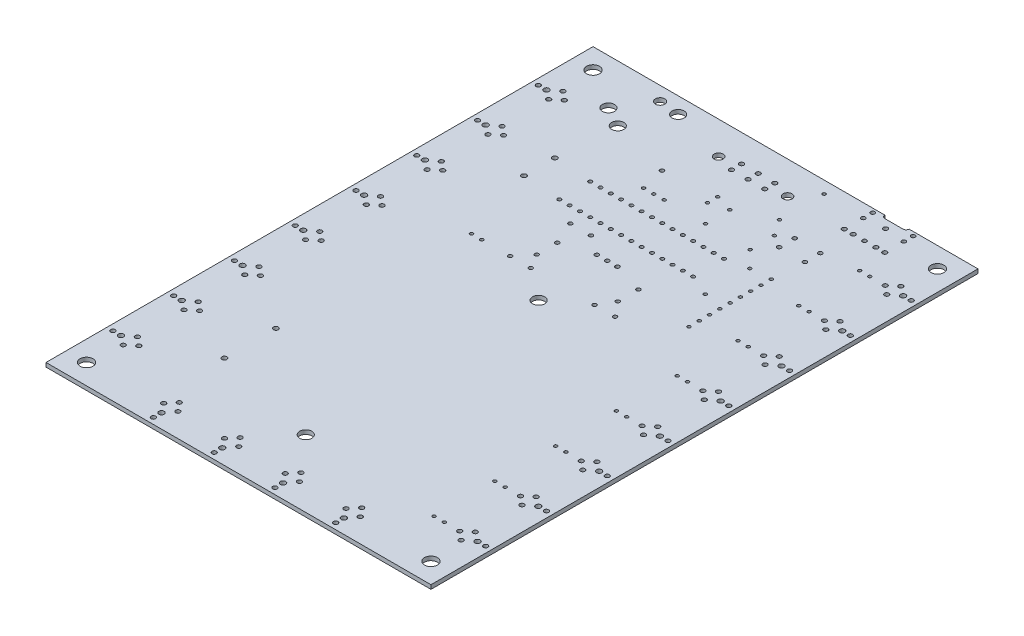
SolidWorks part; units mm, degrees
ref_plane "Plan de face" through (0, 0, 0) normal (0, 0, 1) x (1, 0, 0)
ref_plane "Plan de dessus" through (0, 0, 0) normal (0, 1, 0) x (1, 0, 0)
ref_plane "Plan de droite" through (0, 0, 0) normal (1, 0, 0) x (0, 0, -1)
sketch "Esquisse1" plane through (0, 0, 0) normal (0, 1, 0) x (1, 0, 0)
  line L0 (72.7481, 134.2517) -> (77.249, 134.2517)
  line L1 (0, 0) -> (95, 0)
  line L2 (0, 0) -> (0, 135)
  line L3 (0, 135) -> (71.9988, 135)
  line L4 (95, 0) -> (95, 135)
  line L5 (77.9983, 135) -> (95, 135)
  circle A0 centre (24.9987, 1.4986) radius 0.5512
  circle A1 centre (24.9987, 7.8994) radius 0.5512
  circle A2 centre (26.7487, 5.7988) radius 0.5512
  circle A3 centre (23.2486, 5.7988) radius 0.5512
  circle A4 centre (24.9987, 3.5001) radius 0.6502
  circle A5 centre (39.9999, 1.4986) radius 0.5512
  circle A6 centre (39.9999, 7.8994) radius 0.5512
  circle A7 centre (41.75, 5.7988) radius 0.5512
  circle A8 centre (38.2499, 5.7988) radius 0.5512
  circle A9 centre (39.9999, 3.5001) radius 0.6502
  circle A10 centre (54.9986, 1.4986) radius 0.5512
  circle A11 centre (54.9986, 7.8994) radius 0.5512
  circle A12 centre (56.7487, 5.7988) radius 0.5512
  circle A13 centre (53.2486, 5.7988) radius 0.5512
  circle A14 centre (54.9986, 3.5001) radius 0.6502
  circle A15 centre (69.9999, 1.4986) radius 0.5512
  circle A16 centre (69.9999, 7.8994) radius 0.5512
  circle A17 centre (71.7499, 5.7988) radius 0.5512
  circle A18 centre (68.2498, 5.7988) radius 0.5512
  circle A19 centre (69.9999, 3.5001) radius 0.6502
  circle A20 centre (21.0795, 35.6489) radius 0.5994
  circle A21 centre (21.0795, 22.9489) radius 0.5994
  circle A23 centre (47.5005, 16.5989) radius 1.5011
  circle A24 centre (72.1741, 118.905) radius 0.5004
  circle A25 centre (72.1741, 115.095) radius 0.5004
  circle A26 centre (65.8241, 115.095) radius 0.5004
  circle A27 centre (65.8241, 118.905) radius 0.5004
  circle A28 centre (40.0939, 94.3864) radius 0.4826
  circle A29 centre (35.0139, 94.3864) radius 0.4826
  circle A30 centre (60.452, 79.9922) radius 0.4826
  circle A31 centre (55.372, 79.9922) radius 0.4826
  circle A32 centre (34.5465, 80.0075) radius 0.4826
  circle A33 centre (39.6265, 80.0075) radius 0.4826
  circle A34 centre (57.5005, 83.599) radius 0.4826
  circle A35 centre (57.5005, 88.679) radius 0.4826
  circle A36 centre (37.5006, 83.599) radius 0.4826
  circle A37 centre (37.5006, 88.679) radius 0.4826
  circle A38 centre (20, 121.0996) radius 1.5011
  circle A39 centre (15.0012, 123.7996) radius 1.5011
  circle A40 centre (25.0012, 131.0005) radius 1.5011
  circle A41 centre (20, 131.5491) radius 1.1506
  circle A42 centre (19.0703, 98.8822) radius 0.5994
  circle A43 centre (19.0703, 106.5022) radius 0.5994
  circle A44 centre (5.0013, 5.0013) radius 1.6002
  circle A45 centre (5.0013, 129.9997) radius 1.6002
  circle A46 centre (89.9998, 129.9997) radius 1.6002
  circle A47 centre (89.9998, 5.0013) radius 1.6002
  circle A48 centre (61.5112, 105.8088) radius 0.4496
  circle A49 centre (58.9712, 105.8088) radius 0.4496
  circle A50 centre (56.4312, 105.8088) radius 0.4496
  circle A51 centre (53.8912, 105.8088) radius 0.4496
  circle A52 centre (51.3512, 105.8088) radius 0.4496
  circle A53 centre (48.8112, 105.8088) radius 0.4496
  circle A54 centre (46.2712, 105.8088) radius 0.4496
  circle A55 centre (43.7312, 105.8088) radius 0.4496
  circle A56 centre (41.1912, 105.8088) radius 0.4496
  circle A57 centre (38.6512, 105.8088) radius 0.4496
  circle A58 centre (36.1112, 105.8088) radius 0.4496
  circle A59 centre (33.5712, 105.8088) radius 0.4496
  circle A60 centre (31.0312, 105.8088) radius 0.4496
  circle A61 centre (28.4912, 105.8088) radius 0.4496
  circle A62 centre (28.4912, 98.1888) radius 0.4496
  circle A63 centre (31.0312, 98.1888) radius 0.4496
  circle A64 centre (33.5712, 98.1888) radius 0.4496
  circle A65 centre (36.1112, 98.1888) radius 0.4496
  circle A66 centre (38.6512, 98.1888) radius 0.4496
  circle A67 centre (41.1912, 98.1888) radius 0.4496
  circle A68 centre (43.7312, 98.1888) radius 0.4496
  circle A69 centre (46.2712, 98.1888) radius 0.4496
  circle A70 centre (48.8112, 98.1888) radius 0.4496
  circle A71 centre (51.3512, 98.1888) radius 0.4496
  circle A72 centre (53.8912, 98.1888) radius 0.4496
  circle A73 centre (56.4312, 98.1888) radius 0.4496
  circle A74 centre (58.9712, 98.1888) radius 0.4496
  circle A75 centre (61.5112, 98.1888) radius 0.4496
  circle A76 centre (1.4986, 15.0012) radius 0.5512
  circle A77 centre (7.8994, 15.0012) radius 0.5512
  circle A78 centre (5.7988, 13.2512) radius 0.5512
  circle A79 centre (5.7988, 16.7513) radius 0.5512
  circle A80 centre (3.5001, 15.0012) radius 0.6502
  circle A81 centre (1.4986, 29.9999) radius 0.5512
  circle A82 centre (7.8994, 29.9999) radius 0.5512
  circle A83 centre (5.7988, 28.2499) radius 0.5512
  circle A84 centre (5.7988, 31.75) radius 0.5512
  circle A85 centre (3.5001, 30.0025) radius 0.6502
  circle A86 centre (1.4986, 45.0012) radius 0.5512
  circle A87 centre (7.8994, 45.0012) radius 0.5512
  circle A88 centre (5.7988, 43.2511) radius 0.5512
  circle A89 centre (5.7988, 46.7512) radius 0.5512
  circle A90 centre (3.5001, 45.0012) radius 0.6502
  circle A91 centre (1.4986, 59.9999) radius 0.5512
  circle A92 centre (7.8994, 59.9999) radius 0.5512
  circle A93 centre (5.7988, 58.2498) radius 0.5512
  circle A94 centre (5.7988, 61.7499) radius 0.5512
  circle A95 centre (3.5001, 60.0024) radius 0.6502
  circle A96 centre (1.4986, 75.0011) radius 0.5512
  circle A97 centre (7.8994, 75.0011) radius 0.5512
  circle A98 centre (5.7988, 73.2511) radius 0.5512
  circle A99 centre (5.7988, 76.7512) radius 0.5512
  circle A100 centre (3.5001, 75.0011) radius 0.6502
  circle A101 centre (1.4986, 89.9998) radius 0.5512
  circle A102 centre (7.8994, 89.9998) radius 0.5512
  circle A103 centre (5.7988, 88.2498) radius 0.5512
  circle A104 centre (5.7988, 91.7499) radius 0.5512
  circle A105 centre (3.5001, 90.0024) radius 0.6502
  circle A106 centre (1.4986, 105.0011) radius 0.5512
  circle A107 centre (7.8994, 105.0011) radius 0.5512
  circle A108 centre (5.7988, 103.251) radius 0.5512
  circle A109 centre (5.7988, 106.7511) radius 0.5512
  circle A110 centre (3.5001, 105.0011) radius 0.6502
  circle A111 centre (1.4986, 119.9998) radius 0.5512
  circle A112 centre (7.8994, 119.9998) radius 0.5512
  circle A113 centre (5.7988, 118.2522) radius 0.5512
  circle A114 centre (5.7988, 121.7498) radius 0.5512
  circle A115 centre (3.5001, 120.0023) radius 0.6502
  circle A116 centre (25.0012, 79.9998) radius 0.3988
  circle A117 centre (27.5412, 79.9998) radius 0.3988
  circle A118 centre (74.9986, 132.1918) radius 0.5512
  circle A119 centre (79.9973, 126.9924) radius 0.5512
  circle A120 centre (77.7977, 126.9924) radius 0.5512
  circle A121 centre (72.197, 126.9924) radius 0.5512
  circle A122 centre (69.9973, 126.9924) radius 0.5512
  circle A123 centre (74.9986, 126.9924) radius 0.5004
  circle A124 centre (79.9973, 133.9926) radius 0.5004
  circle A125 centre (79.9973, 131.6914) radius 0.5004
  circle A126 centre (69.9973, 133.9926) radius 0.5004
  circle A127 centre (69.9973, 131.6914) radius 0.5004
  arc A129 (77.249, 134.2517) -> (77.9983, 135) centre (77.249, 135.001) ccw
  arc A130 (71.9988, 135) -> (72.7481, 134.2517) centre (72.7481, 135.001) ccw
  circle A133 centre (83.2891, 15.019) radius 0.3988
  circle A134 centre (80.7491, 15.019) radius 0.3988
  circle A135 centre (83.2891, 30.0177) radius 0.3988
  circle A136 centre (80.7491, 30.0177) radius 0.3988
  circle A137 centre (83.2891, 45.019) radius 0.3988
  circle A138 centre (80.7491, 45.019) radius 0.3988
  circle A139 centre (83.2891, 60.0177) radius 0.3988
  circle A140 centre (80.7491, 60.0177) radius 0.3988
  circle A141 centre (83.2891, 75.0189) radius 0.3988
  circle A142 centre (80.7491, 75.0189) radius 0.3988
  circle A143 centre (83.2891, 90.0176) radius 0.3988
  circle A144 centre (80.7491, 90.0176) radius 0.3988
  circle A145 centre (83.2891, 105.0188) radius 0.3988
  circle A146 centre (80.7491, 105.0188) radius 0.3988
  circle A147 centre (83.2891, 120.0175) radius 0.3988
  circle A148 centre (80.7491, 120.0175) radius 0.3988
  circle A149 centre (47.5005, 115.73) radius 0.3988
  circle A150 centre (47.5005, 118.27) radius 0.3988
  circle A151 centre (93.4999, 14.9987) radius 0.5512
  circle A152 centre (87.1017, 14.9987) radius 0.5512
  circle A153 centre (89.2023, 16.7488) radius 0.5512
  circle A154 centre (89.2023, 13.2486) radius 0.5512
  circle A155 centre (91.501, 14.9987) radius 0.6502
  circle A156 centre (93.4999, 29.9999) radius 0.5512
  circle A157 centre (87.1017, 29.9999) radius 0.5512
  circle A158 centre (89.2023, 31.75) radius 0.5512
  circle A159 centre (89.2023, 28.2499) radius 0.5512
  circle A160 centre (91.501, 29.9999) radius 0.6502
  circle A161 centre (93.4999, 44.9986) radius 0.5512
  circle A162 centre (87.1017, 44.9986) radius 0.5512
  circle A163 centre (89.2023, 46.7487) radius 0.5512
  circle A164 centre (89.2023, 43.2486) radius 0.5512
  circle A165 centre (91.501, 44.9986) radius 0.6502
  circle A166 centre (93.4999, 59.9999) radius 0.5512
  circle A167 centre (87.1017, 59.9999) radius 0.5512
  circle A168 centre (89.2023, 61.7499) radius 0.5512
  circle A169 centre (89.2023, 58.2498) radius 0.5512
  circle A170 centre (91.501, 59.9999) radius 0.6502
  circle A171 centre (93.4999, 74.9986) radius 0.5512
  circle A172 centre (87.1017, 74.9986) radius 0.5512
  circle A173 centre (89.2023, 76.7486) radius 0.5512
  circle A174 centre (89.2023, 73.2485) radius 0.5512
  circle A175 centre (91.501, 74.9986) radius 0.6502
  circle A176 centre (93.4999, 89.9998) radius 0.5512
  circle A177 centre (87.1017, 89.9998) radius 0.5512
  circle A178 centre (89.2023, 91.7499) radius 0.5512
  circle A179 centre (89.2023, 88.2498) radius 0.5512
  circle A180 centre (91.501, 89.9998) radius 0.6502
  circle A181 centre (93.4999, 104.9985) radius 0.5512
  circle A182 centre (87.1017, 104.9985) radius 0.5512
  circle A183 centre (89.2023, 106.7486) radius 0.5512
  circle A184 centre (89.2023, 103.2485) radius 0.5512
  circle A185 centre (91.501, 104.9985) radius 0.6502
  circle A186 centre (93.4999, 119.9998) radius 0.5512
  circle A187 centre (87.1017, 119.9998) radius 0.5512
  circle A188 centre (89.2023, 121.7498) radius 0.5512
  circle A189 centre (89.2023, 118.2497) radius 0.5512
  circle A190 centre (91.501, 119.9998) radius 0.6502
  circle A191 centre (36.4592, 111.0005) radius 0.3988
  circle A192 centre (38.9992, 111.0005) radius 0.3988
  circle A193 centre (41.5392, 111.0005) radius 0.3988
  circle A194 centre (66.7614, 95.9282) radius 0.3988
  circle A195 centre (66.7614, 106.9289) radius 0.3988
  circle A196 centre (59.9999, 121.0005) radius 0.3988
  circle A197 centre (59.9999, 132.0013) radius 0.3988
  circle A198 centre (51.75, 117) radius 0.3988
  circle A199 centre (62.7507, 117) radius 0.3988
  circle A200 centre (62.7507, 111.0005) radius 0.3988
  circle A201 centre (51.75, 111.0005) radius 0.3988
  circle A202 centre (50.0405, 90.9752) radius 0.5004
  circle A203 centre (47.5005, 90.9752) radius 0.5004
  circle A204 centre (44.9605, 90.9752) radius 0.5004
  circle A205 centre (47.5005, 74.074) radius 1.5011
  circle A206 centre (71.6991, 86.9671) radius 0.3988
  circle A207 centre (71.6991, 89.5071) radius 0.3988
  circle A208 centre (71.6991, 92.0471) radius 0.3988
  circle A209 centre (71.6991, 94.5871) radius 0.3988
  circle A210 centre (71.6991, 97.1271) radius 0.3988
  circle A211 centre (71.6991, 99.6671) radius 0.3988
  circle A212 centre (71.6991, 102.2071) radius 0.3988
  circle A213 centre (71.6991, 104.7471) radius 0.3988
  circle A214 centre (71.6991, 107.2871) radius 0.3988
  circle A215 centre (47.5005, 128.2497) radius 0.5512
  circle A216 centre (43.401, 128.2497) radius 0.5512
  circle A217 centre (47.5005, 125.7503) radius 0.5512
  circle A218 centre (43.401, 125.7503) radius 0.5512
  circle A219 centre (51.6001, 128.2497) radius 0.5512
  circle A220 centre (51.6001, 125.7503) radius 0.5512
  circle A221 centre (55.9994, 127) radius 1.0998
  circle A222 centre (38.9992, 127) radius 1.0998
  circle A223 centre (35.0012, 117) radius 0.5004
extrude "Extrusion1" add sketch "Esquisse1" along normal blind 1
